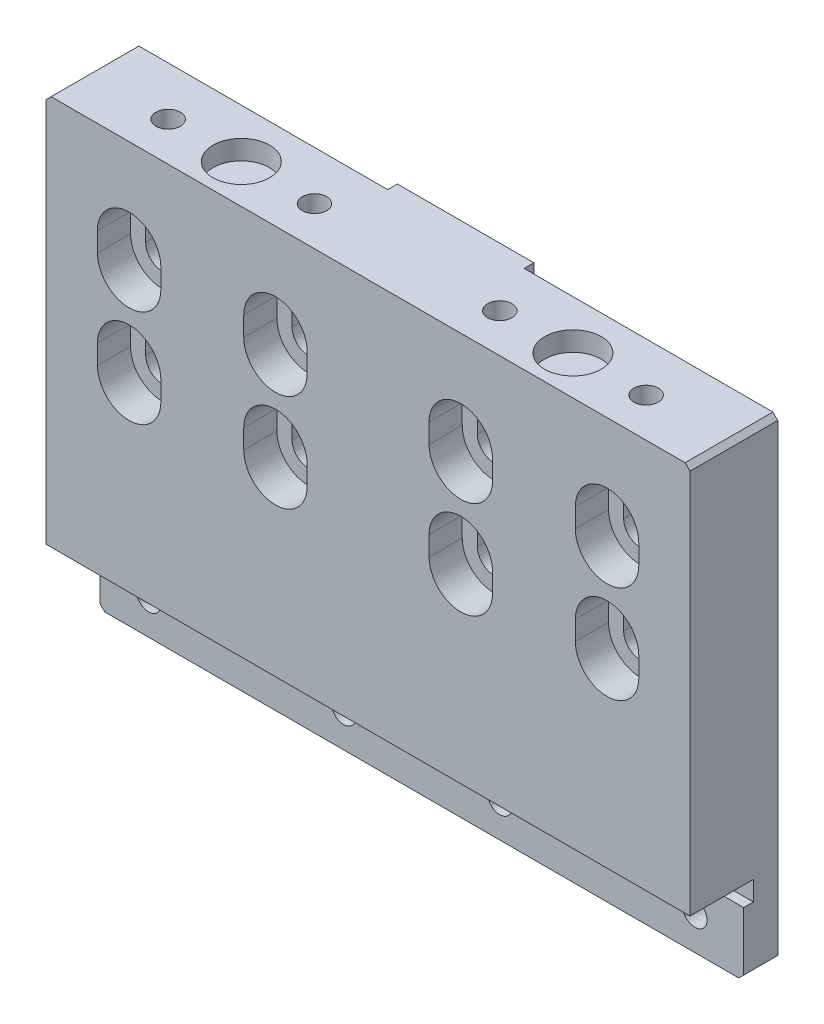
SolidWorks part; units mm, degrees
ref_plane "前视基准面" through (0, 0, 0) normal (0, 0, 1) x (1, 0, 0)
ref_plane "上视基准面" through (0, 0, 0) normal (0, 1, 0) x (1, 0, 0)
ref_plane "右视基准面" through (0, 0, 0) normal (1, 0, 0) x (0, 0, -1)
sketch "草图1" plane through (0, 0, 0) normal (0, 0, 1) x (1, 0, 0)
  line L0 (0, 0) -> (-5, 0)
  line L1 (-5, 0) -> (-5, 10)
  line L2 (-5, 10) -> (-56, 10)
  line L3 (-56, 10) -> (-56, 60)
  line L4 (-56, 60) -> (10, 60)
  line L5 (10, 60) -> (10, 10)
  line L6 (10, 10) -> (5, 10)
  line L7 (5, 10) -> (5, 0)
  line L8 (5, 0) -> (0, 0)
  line L9 (0, 0) -> (0, -11.7458) construction
  point P3 (0, -5.8729)
  dimension "D1" = 10
  dimension "D2" = 66
  dimension "D3" = 10
  dimension "D4" = 10
  dimension "D5" = 50
extrude "凸台-拉伸1" add sketch "草图1" against normal blind 10
sketch "草图2" plane through (0, 0, -10) normal (0, 0, -1) x (-1, 0, 0)
  line L0 (56, 10) -> (5, 10) construction
  line L1 (-5, 10) -> (5, 10)
  line L2 (-5, 10) -> (-5, 0)
  line L3 (-5, 0) -> (5, 0)
  line L4 (5, 10) -> (5, 0)
  line L5 (0, 0) -> (0, 10) construction
  line L6 (-5, 5) -> (5, 5) construction
  line L7 (-5, 0) -> (-5, 10) construction
  point P0 (0, 5)
extrude "凸台-拉伸2" add sketch "草图2" along normal blind 6
sketch "草图3" plane through (0, 0, -10) normal (0, 0, -1) x (-1, 0, 0)
  line L0 (-10, 10) -> (-10, 60) construction
  line L1 (-10, 60) -> (16, 60)
  line L2 (-10, 60) -> (-10, 10)
  line L3 (-10, 10) -> (16, 10)
  line L4 (16, 60) -> (16, 10)
  line L5 (3, 10) -> (3, 60) construction
  line L6 (-10, 35) -> (16, 35) construction
  line L7 (-10, 60) -> (56, 60) construction
  line L8 (-5, 10) -> (-10, 10) construction
  line L10 (30, 60) -> (56, 60)
  line L11 (30, 60) -> (30, 10)
  line L12 (30, 10) -> (56, 10)
  line L13 (56, 60) -> (56, 10)
  point P0 (3, 35)
  dimension "D1" = 26
  dimension "D2" = 14
extrude "切除-拉伸1" cut sketch "草图3" against normal blind 1
sketch "草图5" plane through (0, 0, 0) normal (0, -1, 0) x (1, 0, 0)
  line L0 (-5, -16) -> (-5, 0) construction
  line L1 (-5, 0) -> (5, 0)
  line L2 (-5, 0) -> (-5, -8)
  line L3 (-5, -8) -> (5, -8)
  line L4 (5, 0) -> (5, -8)
  line L5 (0, -8) -> (0, 0) construction
  line L6 (-5, -4) -> (5, -4) construction
  line L7 (-5, 0) -> (5, 0) construction
  line L8 (5, -16) -> (5, 0) construction
  point P0 (0, -4)
  dimension "D1" = 8
extrude "切除-拉伸2" cut sketch "草图5" against normal blind 0.5
hole_wizard "M3 六角凹头螺钉的柱形沉头孔5" positions "草图10" profile "草图11" size "M3" standard "ISO"
sketch "草图10" plane through (0, 0, 0) normal (0, 0, 1) x (1, 0, 0)
  line L0 (10, 60) -> (-56, 60) construction
  line L1 (-56, 60) -> (-56, 10) construction
  line L2 (-47.5, 38.5) -> (-47.5, 40.5) construction
  point P0 (-47.5, 39.5)
  point P3 (-32.5, 39.5)
  point P6 (-32.5, 49.5)
  point P9 (-47.5, 49.5)
  point P26 (0, 0)
  dimension "D1" = 10.5
  dimension "D2" = 10
  dimension "D3" = 15
  dimension "D4" = 8.5
  dimension "D5" = 2
sketch "草图11" plane through (-47.5, 39.5, 0) normal (1, 0, 0) x (0, -1, 0)
  line L0 (0, 0) -> (0, 16)
  line L1 (0, 16) -> (1.7, 16)
  line L3 (1.7, 16) -> (1.7, 3.4)
  line L4 (1.7, 3.4) -> (3.25, 3.4)
  line L5 (3.25, 3.4) -> (3.25, 0)
  line L7 (3.25, 0) -> (0, 0)
  line L11 (0, -6.35) -> (0, 107.95) construction
  dimension "通孔孔直径" = 3.4
  dimension "通孔孔深度" = 16
  dimension "柱形沉头孔直径" = 6.5
  dimension "柱形沉头孔深度" = 3.4
chamfer "倒角1" distance 0.5 angle 45 4 edges at (-56, 60, -4.5) (10, 60, -4.5) (10, 10, -4.5) (-56, 10, -4.5)
sketch "草图22" plane through (0, 0, 0) normal (0, -1, 0) x (1, 0, 0)
  line L1 (-11.6603, 8.9992) -> (12.7722, 8.9992)
  line L2 (-11.6603, 8.9992) -> (-11.6603, -19.4916)
  line L3 (-11.6603, -19.4916) -> (12.7722, -19.4916)
  line L4 (12.7722, 8.9992) -> (12.7722, -19.4916)
  line L5 (0.556, -19.4916) -> (0.556, 8.9992) construction
  line L6 (-11.6603, -5.2462) -> (12.7722, -5.2462) construction
  point P0 (0.556, -5.2462)
extrude "切除-拉伸3" cut sketch "草图22" against normal up to surface (10 mm away)
sketch "草图23" plane through (0, 0, 0) normal (0, 0, 1) x (1, 0, 0)
  line L0 (-55.5, 10) -> (9.5, 10) construction
  line L1 (-56, 20) -> (10, 20)
  line L2 (-56, 20) -> (-56, 10)
  line L3 (-56, 10) -> (10, 10)
  line L4 (10, 20) -> (10, 10)
  line L5 (-23, 10) -> (-23, 20) construction
  line L6 (-56, 15) -> (10, 15) construction
  line L7 (10, 10.5) -> (10, 59.5) construction
  line L8 (-56, 59.5) -> (-56, 10.5) construction
  point P0 (-23, 15)
  dimension "D1" = 10
extrude "切除-拉伸4" cut sketch "草图23" against normal blind 5
sketch "草图24" plane through (0, 0, -5) normal (0, 0, 1) x (1, 0, 0)
  line L0 (10, 10.5) -> (10, 20) construction
  line L1 (-56, 20) -> (10, 20)
  line L2 (-56, 20) -> (-56, 18)
  line L3 (-56, 18) -> (10, 18)
  line L4 (10, 20) -> (10, 18)
  line L5 (-23, 18) -> (-23, 20) construction
  line L6 (-56, 19) -> (10, 19) construction
  line L7 (10, 20) -> (-56, 20) construction
  line L8 (-56, 20) -> (-56, 10.5) construction
  point P0 (-23, 19)
  dimension "D1" = 2
extrude "切除-拉伸5" cut sketch "草图24" against normal blind 1.5
hole_wizard "M3 螺纹孔4" positions "草图25" profile "草图26" tap size "M3" standard "ISO"
sketch "草图25" plane through (0, 0, -5) normal (0, 0, 1) x (1, 0, 0)
  line L0 (-23, 60) -> (-23, 10) construction
  line L1 (9.5, 60) -> (-55.5, 60) construction
  line L2 (-55.5, 10) -> (9.5, 10) construction
  line L3 (-56, 18) -> (-56, 10.5) construction
  point P0 (-51, 15)
  point P3 (-31, 15)
  point P16 (0, 0)
  point P19 (-15, 15)
  point P20 (5, 15)
  dimension "D1" = 20
  dimension "D2" = 5
  dimension "D3" = 5
sketch "草图26" plane through (-51, 15, -5) normal (1, 0, 0) x (0, -1, 0)
  line L0 (0, 0) -> (0, 5)
  line L1 (0, 5) -> (1.25, 5)
  line L2 (1.25, 5) -> (1.25, 0)
  line L5 (1.25, 0) -> (0, 0)
  line L11 (0, -6.35) -> (0, 107.95) construction
  dimension "通孔螺纹孔钻头直径" = 2.5
  dimension "通孔螺纹孔钻头深度" = 5
other "移动面1" parameters "D1"=1.5
sketch "草图27" plane through (0, 60, 0) normal (0, 1, 0) x (1, 0, 0)
  line L1 (9.5, 0) -> (-55.5, 0) construction
  line L2 (-56, 0) -> (-56, 9) construction
  circle A0 centre (-40, 4) radius 2.9
  dimension "D1" = 5.8
  dimension "D2" = 16
  dimension "D3" = 4
extrude "切除-拉伸6" cut sketch "草图27" against normal blind 2
other "移动面2" parameters "D1"=0.5
hole_wizard "M3 螺纹孔3" positions "草图12" profile "草图13" tap size "M3" standard "ISO"
sketch "草图12" plane through (0, 60, 0) normal (0, 1, 0) x (1, 0, 0)
  line L0 (-40, 4) -> (-40, 8.3846) construction
  line L3 (-40, 4) -> (-14.043, 4) construction
  point P0 (-32.5, 4)
  point P3 (-47.5, 4)
  dimension "D1" = 15
sketch "草图13" plane through (-32.5, 60, -4) normal (1, 0, 0) x (0, 0, 1)
  line L0 (0, 0) -> (0, 8.2511)
  line L1 (0, 8.2511) -> (1.25, 7.5)
  line L2 (1.25, 7.5) -> (1.25, 0)
  line L5 (1.25, 0) -> (0, 0)
  line L10 (0, 8.2511) -> (-1.25, 7.5) construction
  line L11 (0, -6.35) -> (0, 107.95) construction
  dimension "螺纹孔钻头直径" = 2.5
  dimension "螺纹孔钻头深度" = 7.5
  dimension "导头角度" = 118
hole_wizard "M3 六角凹头螺钉的柱形沉头孔2" positions "草图28" profile "草图29" size "M3" standard "ISO"
sketch "草图28" plane through (0, 0, 0) normal (0, 0, 1) x (1, 0, 0)
  line L0 (-17.5, 39.3) -> (-17.5, 45.7) construction
  point P0 (-17.5, 42.5)
  point P5 (-2.5, 42.5)
  point P8 (-2.5, 32.5)
  point P11 (-17.5, 32.5)
  dimension "D1" = 6.4
sketch "草图29" plane through (-17.5, 42.5, 0) normal (1, 0, 0) x (0, -1, 0)
  line L0 (0, 0) -> (0, 10)
  line L1 (0, 10) -> (1.8, 10)
  line L3 (1.8, 10) -> (1.8, 3.4)
  line L4 (1.8, 3.4) -> (3.25, 3.4)
  line L5 (3.25, 3.4) -> (3.25, 0)
  line L7 (3.25, 0) -> (0, 0)
  line L11 (0, -6.35) -> (0, 107.95) construction
  dimension "通孔孔直径" = 3.6
  dimension "通孔孔深度" = 10
  dimension "柱形沉头孔直径" = 6.5
  dimension "柱形沉头孔深度" = 3.4
ref_plane "基准面1" through (-23, 0, 0) normal (-1, 0, 0) x (0, 0, 1)
mirror "镜向1" about plane through (-23, 0, 0) normal (-1, 0, 0) of "M3 螺纹孔3", "切除-拉伸6", "M3 六角凹头螺钉的柱形沉头孔5"
